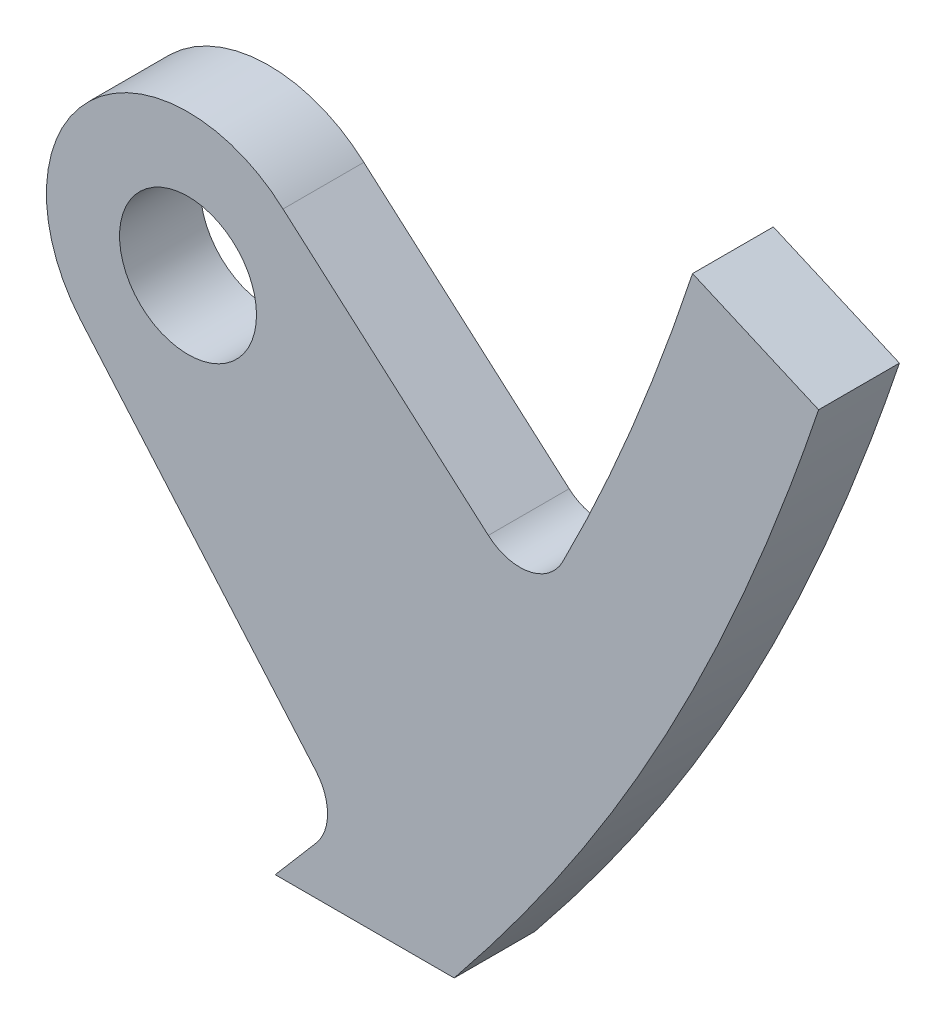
SolidWorks part; units mm, degrees
ref_plane "Front Plane" through (0, 0, 0) normal (0, 0, 1) x (1, 0, 0)
ref_plane "Top Plane" through (0, 0, 0) normal (0, 1, 0) x (1, 0, 0)
ref_plane "Right Plane" through (0, 0, 0) normal (1, 0, 0) x (0, 0, -1)
sketch "Sketch2" plane through (0, 0, 0) normal (0, 0, 1) x (1, 0, 0)
  line L0 (0, 0) -> (0, 106.68) construction
  line L1 (0, 0) -> (-76.2, 0) construction
  line L2 (0, 106.68) -> (-28.575, 106.68) construction
  line L3 (0, 0) -> (0, 106.68) construction
  line L4 (-75.27, 12.7) -> (0, 12.7) construction
  line L5 (-51.0976, 44.45) -> (0, 44.45) construction
  line L6 (-71.1223, 0.1523) -> (-71.1223, 0)
  line L7 (-71.1223, 0) -> (-76.2, 0)
  line L8 (-28.575, 106.68) -> (-23.5432, 106.68)
  line L10 (-23.5432, 105.9822) -> (-23.5432, 106.68)
  spline S0 degree 3 poles (-76.2, 0) (-76.5697, 12.3264) (-70.4254, 26.7635) (-35.695, 54.9593) (-31.1223, 88.3123) (-28.575, 106.68) knots 0 0 0 0 0.192928 0.526147 1 1 1 1
  spline S1 degree 1 poles (-71.1223, 0.1523) (-23.5432, 105.9822) knots 0 0 1 1 construction
  spline S2 degree 3 poles (-71.1223, 0.1523) (-71.1361, 0.6121) (-71.1567, 1.5498) (-71.1646, 3.2821) (-71.1168, 5.2862) (-70.9731, 7.4216) (-70.6767, 9.951) (-70.1306, 12.5718) (-69.2454, 15.1046) (-68.1202, 17.3344) (-66.6722, 19.5511) (-64.8631, 21.9349) (-62.1184, 25.2082) (-58.1372, 29.5028) (-52.8597, 34.9642) (-47.4482, 40.7915) (-42.2515, 47.0605) (-37.6918, 53.9253) (-34.0642, 61.0843) (-31.1698, 68.4658) (-28.9001, 75.9825) (-27.1227, 83.5631) (-25.7154, 91.1411) (-24.7522, 97.394) (-24.0486, 102.3357) (-23.7122, 104.7629) (-23.5432, 105.9822) knots 0 0 0 0 0.007812 0.015625 0.03125 0.046875 0.0625 0.09375 0.125 0.15625 0.1875 0.21875 0.25 0.3125 0.375 0.4375 0.5 0.5625 0.625 0.6875 0.75 0.8125 0.875 0.9375 0.96875 1 1 1 1
  dimension "D1" = 106.68
  dimension "D2" = 28.575
  dimension "D3" = 76.2
  dimension "D4" = 12.7
  dimension "D5" = 44.45
  dimension "D6" = 75.27
  dimension "D7" = 51.0976
  dimension "D8" = 5.08
extrude "Boss-Extrude1" add sketch "Sketch2" along normal blind 2.9972
sketch "Sketch3" plane through (0, 0, 2.9972) normal (0, 0, 1) x (1, 0, 0)
  line L0 (-73.66, 0) -> (-73.66, 2.7432)
  line L1 (-71.1223, 0) -> (-76.2, 0) construction
  line L2 (-73.66, 2.7432) -> (-76.2391, 2.7432)
  line L3 (-73.66, 0) -> (-76.5672, 0)
  line L4 (-76.5672, 0) -> (-76.2391, 2.7432)
  line L5 (-70.0285, 12.7) -> (-72.73, 12.7)
  line L6 (-75.27, 12.7) -> (0, 12.7) construction
  line L7 (-72.73, 12.7) -> (-72.73, 9.906)
  line L8 (-72.73, 9.906) -> (-70.643, 9.906)
  line L9 (-70.643, 9.906) -> (-70.0285, 12.7)
  line L10 (-44.4594, 44.45) -> (-47.2876, 44.45)
  line L11 (-51.0976, 44.45) -> (0, 44.45) construction
  line L12 (-47.2876, 44.45) -> (-47.2876, 41.0895)
  line L13 (-47.2876, 41.0895) -> (-44.4594, 41.0895)
  line L14 (-44.4594, 41.0895) -> (-44.4594, 44.45)
  line L15 (-26.035, 106.68) -> (-26.035, 103.9368)
  line L16 (-28.575, 106.68) -> (-23.5432, 106.68) construction
  line L17 (-26.035, 103.9368) -> (-28.9563, 103.9368)
  line L18 (-28.9563, 103.9368) -> (-28.9563, 106.68)
  line L19 (-28.9563, 106.68) -> (-26.035, 106.68)
  spline S0 degree 3 poles (-76.2, 0) (-76.5697, 12.3264) (-70.4254, 26.7635) (-35.695, 54.9593) (-31.1223, 88.3123) (-28.575, 106.68) knots 0 0 0 0 0.192928 0.526147 1 1 1 1 construction
  spline S1 degree 3 poles (-71.1223, 0.1523) (-71.1361, 0.6121) (-71.1567, 1.5498) (-71.1646, 3.2821) (-71.1168, 5.2862) (-70.9731, 7.4216) (-70.6767, 9.951) (-70.1306, 12.5718) (-69.2454, 15.1046) (-68.1202, 17.3344) (-66.6722, 19.5511) (-64.8631, 21.9349) (-62.1184, 25.2082) (-58.1372, 29.5028) (-52.8597, 34.9642) (-47.4482, 40.7915) (-42.2515, 47.0605) (-37.6918, 53.9253) (-34.0642, 61.0843) (-31.1698, 68.4658) (-28.9001, 75.9825) (-27.1227, 83.5631) (-25.7154, 91.1411) (-24.7522, 97.394) (-24.0486, 102.3357) (-23.7122, 104.7629) (-23.5432, 105.9822) knots 0 0 0 0 0.007812 0.015625 0.03125 0.046875 0.0625 0.09375 0.125 0.15625 0.1875 0.21875 0.25 0.3125 0.375 0.4375 0.5 0.5625 0.625 0.6875 0.75 0.8125 0.875 0.9375 0.96875 1 1 1 1 construction
  dimension "D1" = 2.54
  dimension "D2" = 2.7432
  dimension "D3" = 2.54
  dimension "D4" = 2.794
  dimension "D5" = 3.81
  dimension "D6" = 2.54
  dimension "D7" = 2.7432
extrude "Cut-Extrude1" cut sketch "Sketch3" against normal blind 2.9972
sketch "Sketch4" plane through (0, 0, 2.9972) normal (0, 0, 1) x (1, 0, 0)
  line L0 (-58.3361, 58.6813) -> (-47.446, 46.0533)
  line L1 (-47.446, 46.0533) -> (-39.0309, 55.6532)
  line L2 (-39.0309, 55.6532) -> (-50.8086, 65.9772)
  arc A0 (-58.3361, 58.6813) -> (-50.8086, 65.9772) centre (-54.3318, 62.081) cw
  circle A1 centre (-54.3318, 62.081) radius 2.54
  dimension "D1" = 5.08
extrude "Boss-Extrude2" add sketch "Sketch4" against normal blind 2.9972
fillet "Fillet2" radius 1.778 2 edges at (-48.6089, 47.4018, 1.4986) (-41.5049, 57.8218, 1.4986)
sketch "Sketch5" plane through (0, 0, 2.9972) normal (0, 0, 1) x (1, 0, 0)
  line L0 (-47.2876, 44.45) -> (-83.3709, 44.45)
  line L1 (-83.3709, 44.45) -> (-83.3709, -3.9412)
  line L2 (-83.3709, -3.9412) -> (-3.3662, -3.9412)
  line L3 (-3.3662, -3.9412) -> (-3.3662, 110.9171)
  line L4 (-3.3662, 110.9171) -> (-43.3686, 110.9171)
  line L5 (-43.3686, 110.9171) -> (-43.3686, 74.8753)
  line L6 (-43.3686, 74.8753) -> (-23.3674, 66.162)
  line L7 (-23.3674, 66.162) -> (-23.3674, 44.45)
  line L8 (-23.3674, 44.45) -> (-47.2876, 44.45)
extrude "Cut-Extrude2" cut sketch "Sketch5" against normal blind 7.62
